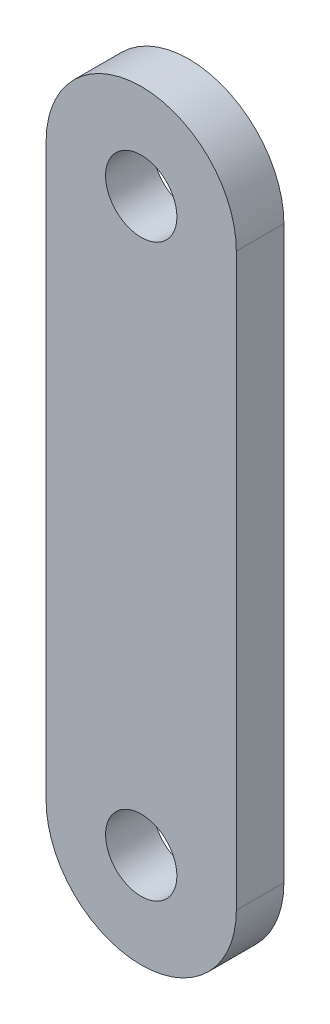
SolidWorks part; units mm, degrees
ref_plane "Front Plane" through (0, 0, 0) normal (0, 0, 1) x (1, 0, 0)
ref_plane "Top Plane" through (0, 0, 0) normal (0, 1, 0) x (1, 0, 0)
ref_plane "Right Plane" through (0, 0, 0) normal (1, 0, 0) x (0, 0, -1)
body saved out of another part "Stock-wood splitter master-1"
